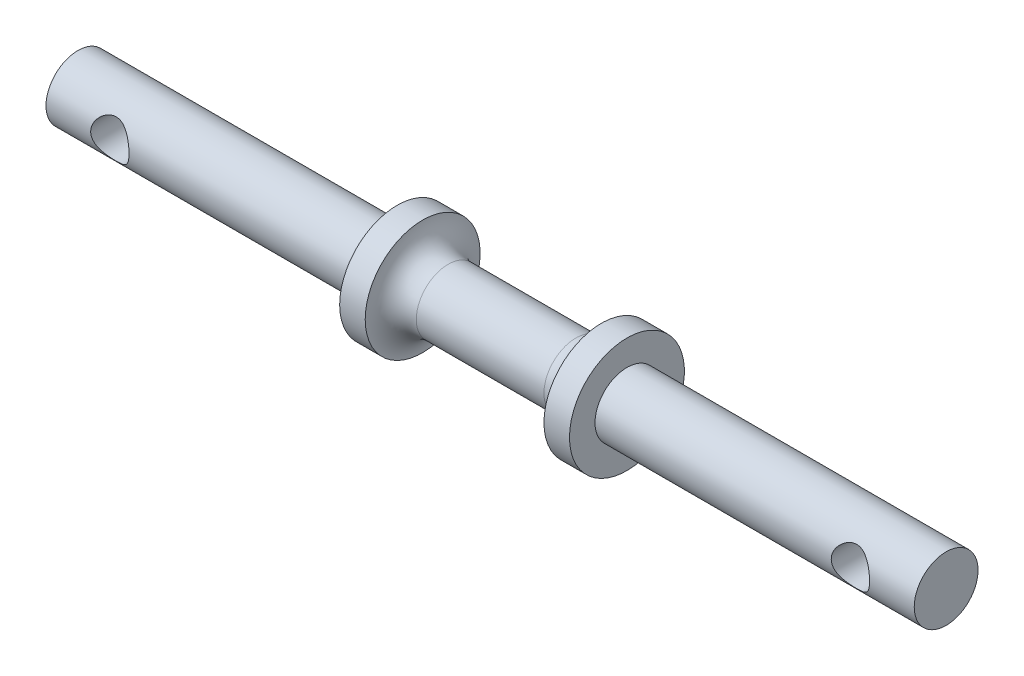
SolidWorks part; units mm, degrees
ref_plane "Front" through (0, 0, 0) normal (0, 0, 1) x (1, 0, 0)
ref_plane "Top" through (0, 0, 0) normal (0, 1, 0) x (1, 0, 0)
ref_plane "Right" through (0, 0, 0) normal (1, 0, 0) x (0, 0, -1)
sketch "Sketch1" plane through (0, 0, 0) normal (0, 0, 1) x (1, 0, 0)
  line L0 (0, 0) -> (68, 0)
  line L1 (0, 2.5) -> (25, 2.5)
  line L2 (25, 4.5) -> (27, 4.5)
  line L3 (68, 0) -> (68, 2.5)
  line L4 (0, 0) -> (0, 2.5)
  line L5 (25, 2.5) -> (25, 4.5)
  line L6 (43, 2.5) -> (43, 4.5)
  line L9 (43, 0) -> (43, 2.5) construction
  line L12 (25, 0) -> (25, 2.5) construction
  line L13 (0, 4.5) -> (68, 4.5) construction
  line L14 (41, 4.5) -> (43, 4.5)
  line L15 (29, 2.5) -> (39, 2.5)
  line L16 (0, 2.5) -> (68, 2.5) construction
  line L17 (43, 2.5) -> (68, 2.5)
  arc A0 (27, 4.5) -> (29, 2.5) centre (29, 4.5) ccw
  arc A1 (39, 2.5) -> (41, 4.5) centre (39, 4.5) ccw
revolve "Revolve1" add sketch "Sketch1" angle 360 about L0
sketch "Sketch2" plane through (0, 0, 0) normal (0, 0, 1) x (1, 0, 0)
  circle A0 centre (63, 0) radius 1.5
  circle A1 centre (5, 0) radius 1.5
extrude "Cut-Extrude1" cut sketch "Sketch2" against normal mid plane 10
